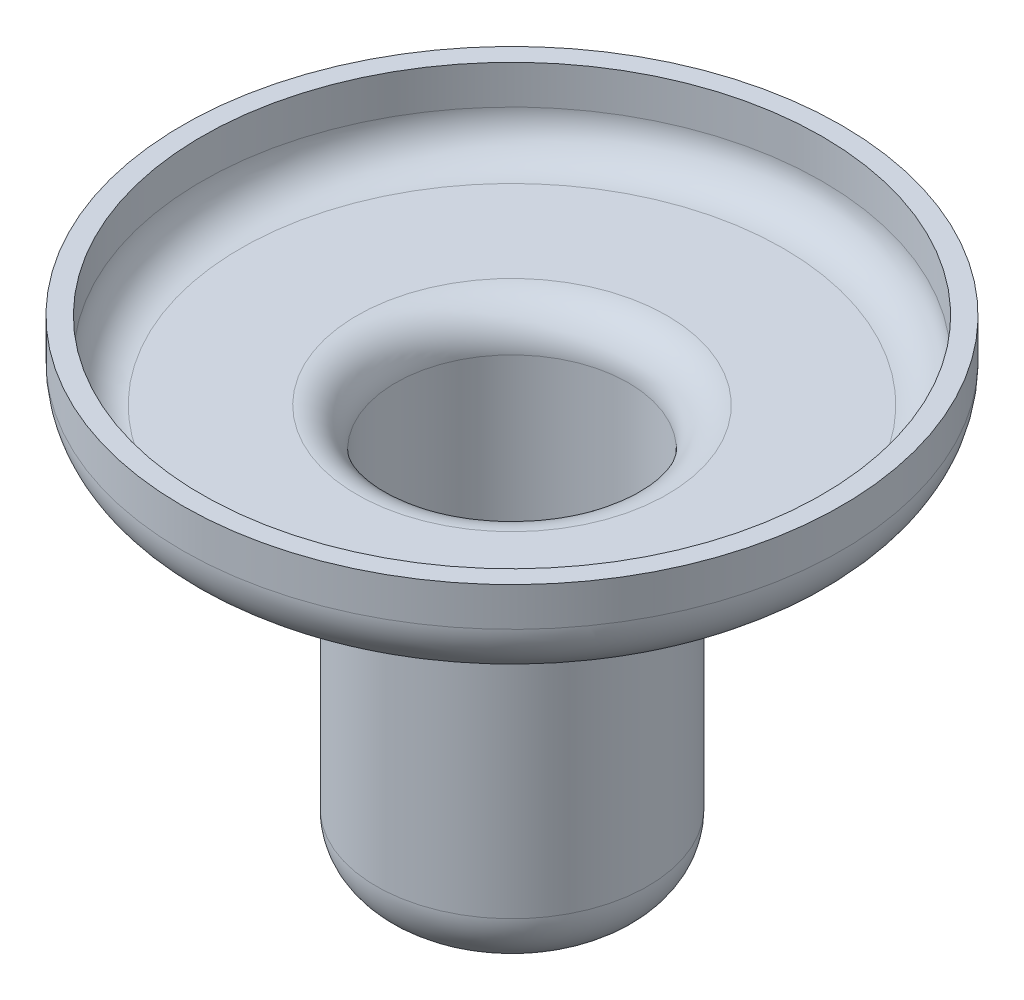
SolidWorks part; units mm, degrees
ref_plane "Face" through (0, 0, 0) normal (0, 0, 1) x (1, 0, 0)
ref_plane "Dessus" through (0, 0, 0) normal (0, 1, 0) x (1, 0, 0)
ref_plane "Droite" through (0, 0, 0) normal (1, 0, 0) x (0, 0, -1)
sketch "Esquisse1" plane through (0, 0, 0) normal (0, 0, 1) x (1, 0, 0)
  line L0 (0, 0) -> (0, 54.7843) construction
  line L1 (6, -2) -> (6, -18)
  line L2 (4, -20) -> (0, -20)
  line L5 (8, 0) -> (14, 0)
  line L6 (16, 2) -> (16, 4)
  arc A0 (6, -2) -> (8, 0) centre (8, -2) cw
  arc A1 (14, 0) -> (16, 2) centre (14, 2) ccw
  arc A2 (6, -18) -> (4, -20) centre (4, -18) cw
  point P12 (16, 0)
  dimension "D5" = 2
  dimension "D6" = 2
  dimension "D1" = 6
  dimension "D2" = 20
  dimension "D3" = 16
  dimension "D4" = 4
revolve "Révol.-Mince1" add sketch "Esquisse1" angle 360 about L0
